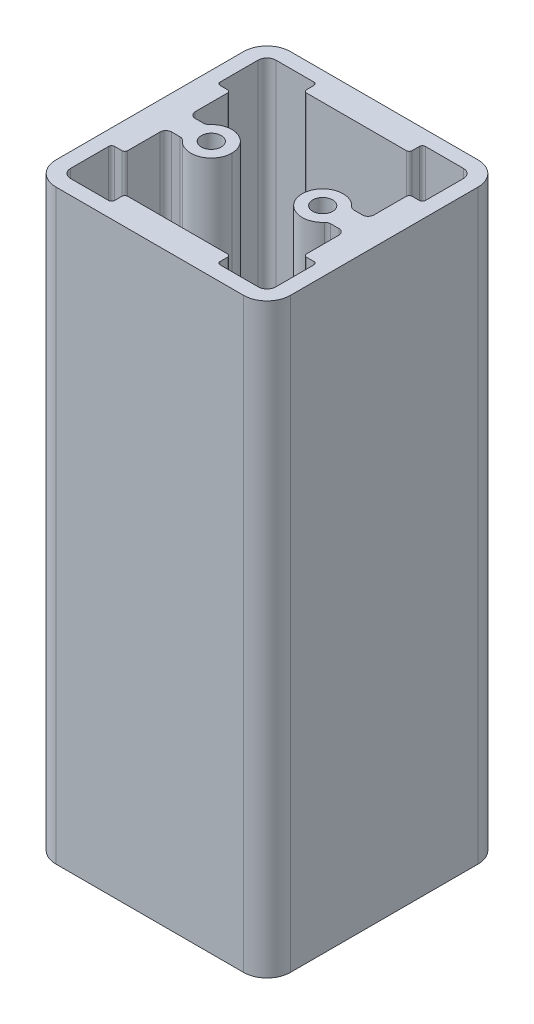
SolidWorks part; units mm, degrees
ref_plane "Front Plane" through (0, 0, 0) normal (0, 0, 1) x (1, 0, 0)
ref_plane "Top Plane" through (0, 0, 0) normal (0, 1, 0) x (1, 0, 0)
ref_plane "Right Plane" through (0, 0, 0) normal (1, 0, 0) x (0, 0, -1)
imported_body "item_0044050_Telescope_Profile_8_40x40_L=20_1.stp"
sketch "Sketch1" plane through (0, 10, 0) normal (0, 1, 0) x (1, 0, 0)
  line L0 (9, -17) -> (9, -15.75) construction
  line L1 (8.5, -15.25) -> (-8.5, -15.25) construction
  line L2 (-9, -15.75) -> (-9, -17) construction
  line L3 (-9.5, -17.5) -> (-16, -17.5) construction
  line L4 (-20, 16) -> (-20, -16)
  line L5 (-16, -20) -> (16, -20)
  line L6 (20, -16) -> (20, 16)
  line L7 (16, 20) -> (-16, 20)
  line L8 (-20, 16) -> (-20, -16)
  line L9 (-16, -20) -> (16, -20)
  line L10 (20, -16) -> (20, 16)
  line L11 (16, 20) -> (-16, 20)
  line L12 (-17.5, -16) -> (-17.5, -9.5) construction
  line L13 (-17, -9) -> (-15.75, -9) construction
  line L14 (-15.25, -8.5) -> (-15.25, -3) construction
  line L15 (-14.25, -2) -> (-12.8541, -2) construction
  line L16 (-12.8541, 2) -> (-14.25, 2) construction
  line L17 (-15.25, 3) -> (-15.25, 8.5) construction
  line L18 (-17.5, 9.5) -> (-17.5, 16) construction
  line L19 (-15.75, 9) -> (-17, 9) construction
  line L20 (-16, 17.5) -> (-9.5, 17.5) construction
  line L21 (-9, 17) -> (-9, 15.75) construction
  line L22 (-8.5, 15.25) -> (8.5, 15.25) construction
  line L23 (9, 15.75) -> (9, 17) construction
  line L24 (9.5, 17.5) -> (16, 17.5) construction
  line L25 (17.5, 16) -> (17.5, 9.5) construction
  line L26 (17, 9) -> (15.75, 9) construction
  line L27 (15.25, 8.5) -> (15.25, 3) construction
  line L28 (14.25, 2) -> (12.8541, 2) construction
  line L29 (12.8541, -2) -> (14.25, -2) construction
  line L30 (15.25, -3) -> (15.25, -8.5) construction
  line L31 (15.75, -9) -> (17, -9) construction
  line L32 (17.5, -9.5) -> (17.5, -16) construction
  line L33 (16, -17.5) -> (9.5, -17.5) construction
  line L34 (9, -17) -> (9, -15.75)
  line L35 (8.5, -15.25) -> (-8.5, -15.25)
  line L36 (-9, -15.75) -> (-9, -17)
  line L37 (-9.5, -17.5) -> (-16, -17.5)
  line L38 (-17.5, -16) -> (-17.5, -9.5)
  line L39 (-17, -9) -> (-15.75, -9)
  line L40 (-15.25, -8.5) -> (-15.25, -3)
  line L41 (-14.25, -2) -> (-12.8541, -2)
  line L42 (-12.8541, 2) -> (-14.25, 2)
  line L43 (-15.25, 3) -> (-15.25, 8.5)
  line L44 (-17.5, 9.5) -> (-17.5, 16)
  line L45 (-15.75, 9) -> (-17, 9)
  line L46 (-16, 17.5) -> (-9.5, 17.5)
  line L47 (-9, 17) -> (-9, 15.75)
  line L48 (-8.5, 15.25) -> (8.5, 15.25)
  line L49 (9, 15.75) -> (9, 17)
  line L50 (9.5, 17.5) -> (16, 17.5)
  line L51 (17.5, 16) -> (17.5, 9.5)
  line L52 (17, 9) -> (15.75, 9)
  line L53 (15.25, 8.5) -> (15.25, 3)
  line L54 (14.25, 2) -> (12.8541, 2)
  line L55 (12.8541, -2) -> (14.25, -2)
  line L56 (15.25, -3) -> (15.25, -8.5)
  line L57 (15.75, -9) -> (17, -9)
  line L58 (17.5, -9.5) -> (17.5, -16)
  line L59 (16, -17.5) -> (9.5, -17.5)
  arc A0 (7.8, 0) -> (11.2, 0) centre (9.5, 0) ccw construction
  arc A1 (11.2, 0) -> (7.8, 0) centre (9.5, 0) ccw construction
  arc A2 (9, -15.75) -> (8.5, -15.25) centre (8.5, -15.75) ccw construction
  arc A3 (9, -17) -> (9.5, -17.5) centre (9.5, -17) ccw construction
  arc A4 (-16, 20) -> (-20, 16) centre (-16, 16) ccw
  arc A5 (-20, -16) -> (-16, -20) centre (-16, -16) ccw
  arc A6 (16, -20) -> (20, -16) centre (16, -16) ccw
  arc A7 (20, 16) -> (16, 20) centre (16, 16) ccw
  arc A8 (-16, 20) -> (-20, 16) centre (-16, 16) ccw
  arc A9 (-20, -16) -> (-16, -20) centre (-16, -16) ccw
  arc A10 (16, -20) -> (20, -16) centre (16, -16) ccw
  arc A11 (20, 16) -> (16, 20) centre (16, 16) ccw
  arc A12 (-8.5, -15.25) -> (-9, -15.75) centre (-8.5, -15.75) ccw construction
  arc A13 (-9.5, -17.5) -> (-9, -17) centre (-9.5, -17) ccw construction
  arc A14 (-17.5, -16) -> (-16, -17.5) centre (-16, -16) ccw construction
  arc A15 (-17, -9) -> (-17.5, -9.5) centre (-17, -9.5) ccw construction
  arc A16 (-15.75, -9) -> (-15.25, -8.5) centre (-15.75, -8.5) ccw construction
  arc A17 (-14.25, -2) -> (-15.25, -3) centre (-14.25, -3) ccw construction
  arc A18 (-12.1088, -2.3333) -> (-12.8541, -2) centre (-12.8541, -3) ccw construction
  arc A19 (-11.2, 0) -> (-7.8, 0) centre (-9.5, 0) ccw construction
  arc A20 (-12.1088, -2.3333) -> (-6, 0) centre (-9.5, 0) ccw construction
  arc A21 (-7.8, 0) -> (-11.2, 0) centre (-9.5, 0) ccw construction
  arc A22 (-6, 0) -> (-12.1088, 2.3333) centre (-9.5, 0) ccw construction
  arc A23 (-12.8541, 2) -> (-12.1088, 2.3333) centre (-12.8541, 3) ccw construction
  arc A24 (-15.25, 3) -> (-14.25, 2) centre (-14.25, 3) ccw construction
  arc A25 (-15.25, 8.5) -> (-15.75, 9) centre (-15.75, 8.5) ccw construction
  arc A26 (-17.5, 9.5) -> (-17, 9) centre (-17, 9.5) ccw construction
  arc A27 (-16, 17.5) -> (-17.5, 16) centre (-16, 16) ccw construction
  arc A28 (-9, 17) -> (-9.5, 17.5) centre (-9.5, 17) ccw construction
  arc A29 (-9, 15.75) -> (-8.5, 15.25) centre (-8.5, 15.75) ccw construction
  arc A30 (8.5, 15.25) -> (9, 15.75) centre (8.5, 15.75) ccw construction
  arc A31 (9.5, 17.5) -> (9, 17) centre (9.5, 17) ccw construction
  arc A32 (17.5, 16) -> (16, 17.5) centre (16, 16) ccw construction
  arc A33 (17, 9) -> (17.5, 9.5) centre (17, 9.5) ccw construction
  arc A34 (15.75, 9) -> (15.25, 8.5) centre (15.75, 8.5) ccw construction
  arc A35 (14.25, 2) -> (15.25, 3) centre (14.25, 3) ccw construction
  arc A36 (12.1088, 2.3333) -> (12.8541, 2) centre (12.8541, 3) ccw construction
  arc A37 (12.1088, 2.3333) -> (6, 0) centre (9.5, 0) ccw construction
  arc A38 (6, 0) -> (12.1088, -2.3333) centre (9.5, 0) ccw construction
  arc A39 (12.8541, -2) -> (12.1088, -2.3333) centre (12.8541, -3) ccw construction
  arc A40 (15.25, -3) -> (14.25, -2) centre (14.25, -3) ccw construction
  arc A41 (15.25, -8.5) -> (15.75, -9) centre (15.75, -8.5) ccw construction
  arc A42 (17.5, -9.5) -> (17, -9) centre (17, -9.5) ccw construction
  arc A43 (16, -17.5) -> (17.5, -16) centre (16, -16) ccw construction
  arc A44 (7.8, 0) -> (11.2, 0) centre (9.5, 0) ccw
  arc A45 (11.2, 0) -> (7.8, 0) centre (9.5, 0) ccw
  arc A46 (9, -15.75) -> (8.5, -15.25) centre (8.5, -15.75) ccw
  arc A47 (9, -17) -> (9.5, -17.5) centre (9.5, -17) ccw
  arc A48 (-8.5, -15.25) -> (-9, -15.75) centre (-8.5, -15.75) ccw
  arc A49 (-9.5, -17.5) -> (-9, -17) centre (-9.5, -17) ccw
  arc A50 (-17.5, -16) -> (-16, -17.5) centre (-16, -16) ccw
  arc A51 (-17, -9) -> (-17.5, -9.5) centre (-17, -9.5) ccw
  arc A52 (-15.75, -9) -> (-15.25, -8.5) centre (-15.75, -8.5) ccw
  arc A53 (-14.25, -2) -> (-15.25, -3) centre (-14.25, -3) ccw
  arc A54 (-12.1088, -2.3333) -> (-12.8541, -2) centre (-12.8541, -3) ccw
  arc A55 (-11.2, 0) -> (-7.8, 0) centre (-9.5, 0) ccw
  arc A56 (-12.1088, -2.3333) -> (-6, 0) centre (-9.5, 0) ccw
  arc A57 (-7.8, 0) -> (-11.2, 0) centre (-9.5, 0) ccw
  arc A58 (-6, 0) -> (-12.1088, 2.3333) centre (-9.5, 0) ccw
  arc A59 (-12.8541, 2) -> (-12.1088, 2.3333) centre (-12.8541, 3) ccw
  arc A60 (-15.25, 3) -> (-14.25, 2) centre (-14.25, 3) ccw
  arc A61 (-15.25, 8.5) -> (-15.75, 9) centre (-15.75, 8.5) ccw
  arc A62 (-17.5, 9.5) -> (-17, 9) centre (-17, 9.5) ccw
  arc A63 (-16, 17.5) -> (-17.5, 16) centre (-16, 16) ccw
  arc A64 (-9, 17) -> (-9.5, 17.5) centre (-9.5, 17) ccw
  arc A65 (-9, 15.75) -> (-8.5, 15.25) centre (-8.5, 15.75) ccw
  arc A66 (8.5, 15.25) -> (9, 15.75) centre (8.5, 15.75) ccw
  arc A67 (9.5, 17.5) -> (9, 17) centre (9.5, 17) ccw
  arc A68 (17.5, 16) -> (16, 17.5) centre (16, 16) ccw
  arc A69 (17, 9) -> (17.5, 9.5) centre (17, 9.5) ccw
  arc A70 (15.75, 9) -> (15.25, 8.5) centre (15.75, 8.5) ccw
  arc A71 (14.25, 2) -> (15.25, 3) centre (14.25, 3) ccw
  arc A72 (12.1088, 2.3333) -> (12.8541, 2) centre (12.8541, 3) ccw
  arc A73 (12.1088, 2.3333) -> (6, 0) centre (9.5, 0) ccw
  arc A74 (6, 0) -> (12.1088, -2.3333) centre (9.5, 0) ccw
  arc A75 (12.8541, -2) -> (12.1088, -2.3333) centre (12.8541, -3) ccw
  arc A76 (15.25, -3) -> (14.25, -2) centre (14.25, -3) ccw
  arc A77 (15.25, -8.5) -> (15.75, -9) centre (15.75, -8.5) ccw
  arc A78 (17.5, -9.5) -> (17, -9) centre (17, -9.5) ccw
  arc A79 (16, -17.5) -> (17.5, -16) centre (16, -16) ccw
  dimension "D1" = 0
extrude "Boss-Extrude1" add sketch "Sketch1" along normal blind 80
sketch "Sketch2" plane through (0, 0, -20) normal (0, 0, -1) x (-1, 0, 0)
  line L0 (-16, 90) -> (16, 90) construction
  circle A0 centre (0, 60) radius 3
  dimension "D2" = 6
  dimension "D1" = 30
extrude "Cut-Extrude1" cut sketch "Sketch2" against normal up to next
